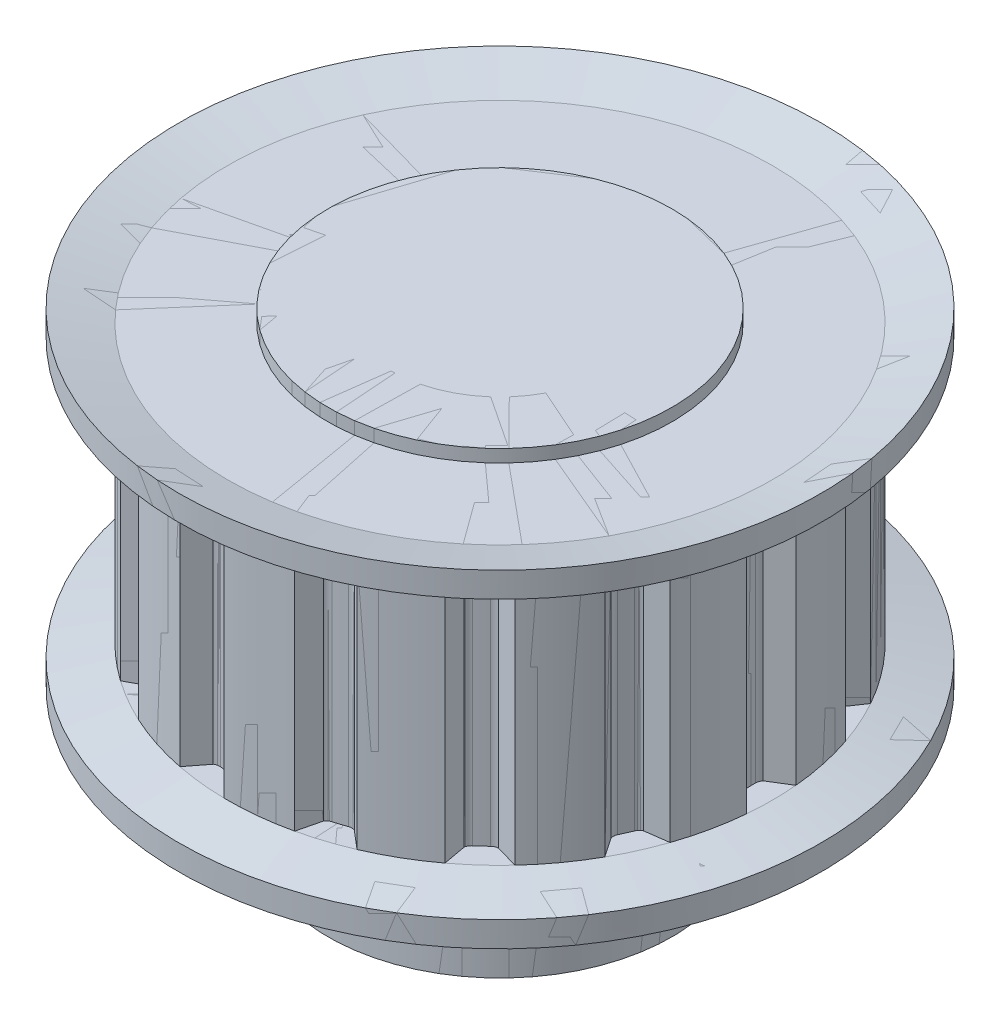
SolidWorks part; units mm, degrees
ref_plane "Face" through (0, 0, 0) normal (0, 0, 1) x (1, 0, 0)
ref_plane "Dessus" through (0, 0, 0) normal (0, 1, 0) x (1, 0, 0)
ref_plane "Droite" through (0, 0, 0) normal (1, 0, 0) x (0, 0, -1)
imported_body "Importée1"
ref_plane "Plan1" through (0, 12.85, 0) normal (0, 1, 0) x (-1, 0, 0)
sketch "Esquisse1" plane through (0, 20, 0) normal (0, 1, 0) x (-1, 0, 0)
  circle A0 centre (0, 0) radius 4.75
  circle A1 centre (0, 0) radius 7.5 construction
  dimension "D1" = 9.5
extrude "Enlèv. mat.-Extru.1" cut sketch "Esquisse1" against normal through all
